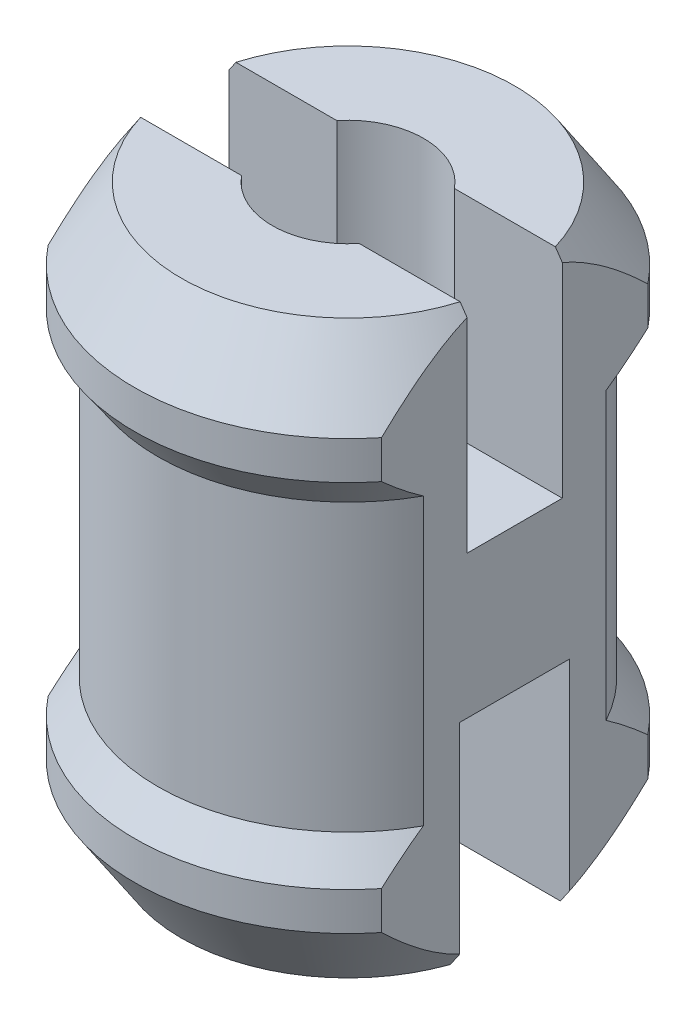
SolidWorks part; units mm, degrees
ref_plane "Front Plane" through (0, 0, 0) normal (0, 0, 1) x (1, 0, 0)
ref_plane "Top Plane" through (0, 0, 0) normal (0, 1, 0) x (1, 0, 0)
ref_plane "Right Plane" through (0, 0, 0) normal (1, 0, 0) x (0, 0, -1)
sketch "Sketch1" plane through (0, 0, 0) normal (0, 1, 0) x (1, 0, 0)
  line L1 (-41.8372, 33.0832) -> (41.8372, 33.0832)
  line L2 (-41.8372, 33.0832) -> (-41.8372, -33.0832)
  line L3 (-41.8372, -33.0832) -> (41.8372, -33.0832)
  line L4 (41.8372, 33.0832) -> (41.8372, -33.0832)
  line L5 (-41.8372, 33.0832) -> (41.8372, -33.0832) construction
  line L6 (-41.8372, -33.0832) -> (41.8372, 33.0832) construction
  point P0 (0, 0)
ref_plane "Plane1" through (0, 0, 17.9328) normal (0, 0, 1) x (1, 0, 0)
sketch "Sketch5" plane through (0, 0, 17.9328) normal (0, 0, 1) x (1, 0, 0)
  line L0 (-17.036, 16) -> (-18.947, 16)
  line L1 (-18.947, 16) -> (-18.947, 11.5)
  line L2 (-18.947, 11.5) -> (-20.536, 11.5)
  line L3 (-20.536, 11.5) -> (-20.536, 10)
  line L4 (-20.536, 10) -> (-16.5442, 10)
  line L5 (-16.5442, 10) -> (-16.5442, 13)
  line L6 (-16.5442, 13) -> (-16.0559, 13.7)
  line L7 (-16.0559, 13.7) -> (-16.0559, 14.5)
  line L8 (-16.0559, 14.5) -> (-17.036, 16)
  line L9 (-27.2796, 10) -> (-13.7924, 10) construction
  dimension "D1" = 3.9917
  dimension "D2" = 1.911
  dimension "D3" = 4.5
  dimension "D4" = 3
  dimension "D5" = 0.8
  dimension "D6" = 1.5
  dimension "D7" = 0.7
  dimension "D8" = 4.4801
  dimension "D9" = 3.5
sketch "Sketch6" plane through (0, 0, 17.9328) normal (0, 0, 1) x (1, 0, 0)
  line L0 (-16.0559, 14.5) -> (-17.036, 16) construction
  line L1 (-17.036, 16) -> (-18.947, 16) construction
  line L2 (-18.947, 16) -> (-18.947, 11.5) construction
  line L3 (-16.5442, 10) -> (-16.5442, 13) construction
  line L4 (-16.5442, 13) -> (-16.0559, 13.7) construction
  line L5 (-16.0559, 13.7) -> (-16.0559, 14.5) construction
  line L7 (-18.947, 11.5) -> (-20.536, 11.5) construction
  line L8 (-20.536, 11.5) -> (-20.536, 10) construction
  line L9 (-16.0559, 14.5) -> (-17.036, 16)
  line L10 (-17.036, 16) -> (-18.947, 16)
  line L11 (-18.947, 16) -> (-18.947, 11.5)
  line L12 (-16.5442, 7) -> (-16.5442, 13)
  line L13 (-16.5442, 13) -> (-16.0559, 13.7)
  line L14 (-16.0559, 13.7) -> (-16.0559, 14.5)
  line L16 (-18.947, 11.5) -> (-20.536, 11.5)
  line L17 (-20.536, 11.5) -> (-20.536, 8.5)
  line L18 (-18.947, 8.5) -> (-20.536, 8.5)
  line L19 (-16.0559, 6.3) -> (-16.0559, 5.5)
  line L20 (-16.5442, 7) -> (-16.0559, 6.3)
  line L21 (-18.947, 4) -> (-18.947, 8.5)
  line L22 (-17.036, 4) -> (-18.947, 4)
  line L23 (-16.0559, 5.5) -> (-17.036, 4)
revolve "Revolve1" add sketch "Sketch6" angle 360 about L17
sketch "Sketch7" plane through (0, 16, 0) normal (0, 1, 0) x (1, 0, 0)
  line L0 (-25.016, -17.9328) -> (-16.0559, -17.9328) construction
  line L1 (-20.536, -12.7939) -> (-20.536, -23.8809) construction
  line L2 (-24.903, -18.9328) -> (-16.169, -18.9328)
  line L3 (-24.903, -16.9328) -> (-16.169, -16.9328)
  line L4 (-27.3195, -16.9328) -> (-15.0498, -16.9328) construction
  line L5 (-27.3195, -17.9328) -> (-15.0498, -17.9328) construction
  line L6 (-27.3195, -18.9328) -> (-15.0498, -18.9328) construction
  line L7 (-24.036, -15.1362) -> (-24.036, -20.7294)
  line L8 (-17.036, -15.1362) -> (-17.036, -20.7294)
  line L9 (-24.036, -12.7939) -> (-24.036, -23.8809) construction
  line L10 (-17.036, -12.7939) -> (-17.036, -23.8809) construction
  line L11 (-17.036, -25.4816) -> (-15.3202, -25.4816)
  line L12 (-24.036, -12.2267) -> (-25.7517, -12.2267)
  line L13 (-24.036, -12.2267) -> (-24.036, -25.4816)
  line L14 (-24.036, -25.4816) -> (-25.7517, -25.4816)
  line L15 (-25.7517, -12.2267) -> (-25.7517, -25.4816)
  line L16 (-15.3202, -12.2267) -> (-15.3202, -25.4816)
  line L17 (-17.036, -12.2267) -> (-15.3202, -12.2267)
  line L18 (-17.036, -12.2267) -> (-17.036, -25.4816)
  circle A0 centre (-20.536, -17.9328) radius 1.589 construction
  circle A1 centre (-20.536, -17.9328) radius 4.4801
  arc A2 (-24.036, -15.1362) -> (-24.036, -20.7294) centre (-20.536, -17.9328) ccw
  circle A3 centre (-20.536, -17.9328) radius 3.5
  arc A4 (-23.8901, -16.9328) -> (-23.8901, -18.9328) centre (-20.536, -17.9328) ccw
  circle A5 centre (-20.536, -17.9328) radius 1.589
  arc A6 (-17.036, -20.7294) -> (-17.036, -15.1362) centre (-20.536, -17.9328) ccw
  arc A7 (-17.1819, -18.9328) -> (-17.1819, -16.9328) centre (-20.536, -17.9328) ccw
  dimension "D1" = 1
  dimension "D2" = 1
  dimension "D3" = 0
  dimension "D4" = 0
  dimension "D5" = 3.5
  dimension "D6" = 3.5
extrude "Cut-Extrude3" cut sketch "Sketch7" against normal through all contours A2 L13 L12 L15 L14 | A6 L18 L11 L16 L17 | L2 A2 L7 | L3 A6 L8 | L2 A6 L3 L8 | L8 A6 L2 | L3 A2 L2 L7 | L7 A2 L3
sketch "Sketch8" plane through (0, 16, 0) normal (0, 1, 0) x (1, 0, 0)
  line L0 (-24.903, -16.9328) -> (-16.169, -16.9328) construction
  line L1 (-24.903, -18.9328) -> (-16.169, -18.9328) construction
  line L2 (-24.903, -16.9328) -> (-16.169, -16.9328)
  line L3 (-24.903, -18.9328) -> (-16.169, -18.9328)
  line L5 (-24.903, -16.9328) -> (-16.169, -16.9328)
  line L6 (-24.903, -16.9328) -> (-24.903, -18.9328)
  line L7 (-24.903, -18.9328) -> (-16.169, -18.9328)
  line L8 (-16.169, -16.9328) -> (-16.169, -18.9328)
extrude "Cut-Extrude4" cut sketch "Sketch8" against normal blind 4.5 contours L2 L6 L3 M3 M2 | L3 L2 M3 M1 M2 | L3 L2 M1 | L3 L2 M1 M3 M2 | L8 L2 L3 M2 M3
sketch "Sketch9" plane through (0, 4, 0) normal (0, -1, 0) x (1, 0, 0)
  line L0 (-20.536, 17.9328) -> (-16.5442, 17.9328) construction
  line L1 (-14.3441, 16.7778) -> (-26.0561, 16.7778)
  line L2 (-14.3441, 16.7778) -> (-14.3441, 19.0878)
  line L3 (-14.3441, 19.0878) -> (-26.0561, 19.0878)
  line L4 (-26.0561, 16.7778) -> (-26.0561, 19.0878)
  line L5 (-20.536, 17.9328) -> (-16.5442, 17.9328) construction
  line L6 (-14.3441, 17.9328) -> (-26.0561, 17.9328) construction
extrude "Cut-Extrude5" cut sketch "Sketch9" against normal blind 4.5
